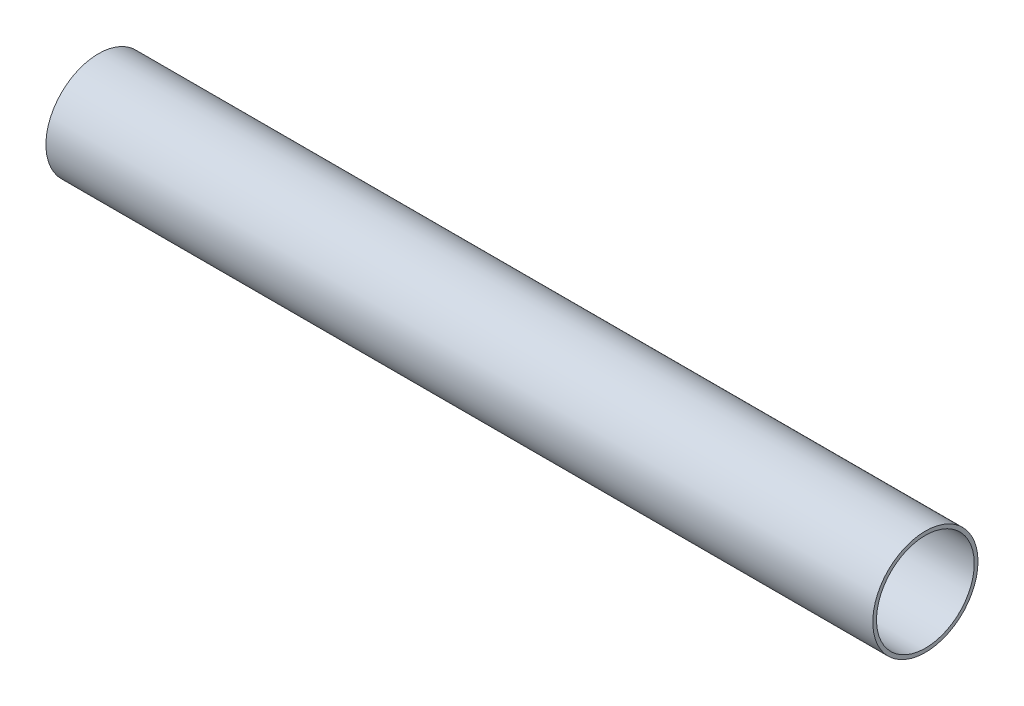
SolidWorks part; units mm, degrees
ref_plane "Plan1" through (0, 0, 0) normal (0, 0, 1) x (1, 0, 0)
ref_plane "Plan2" through (0, 0, 0) normal (0, 1, 0) x (1, 0, 0)
ref_plane "Plan3" through (0, 0, 0) normal (1, 0, 0) x (0, 0, -1)
sketch "Esquisse1" plane through (0, 0, 0) normal (0, 0, 1) x (1, 0, 0)
  line L0 (-20, 9.75) -> (145, 9.75)
  line L1 (145, 9.75) -> (145, 10.5)
  line L2 (145, 10.5) -> (-20, 10.5)
  line L3 (-20, 10.5) -> (-20, 9.75)
  line L4 (40, 0) -> (-30, 0) construction
  dimension "D1" = 0.75
  dimension "D2" = 165
  dimension "D3" = 9.75
revolve "Base-Révolution" add sketch "Esquisse1" angle 360 about L4
